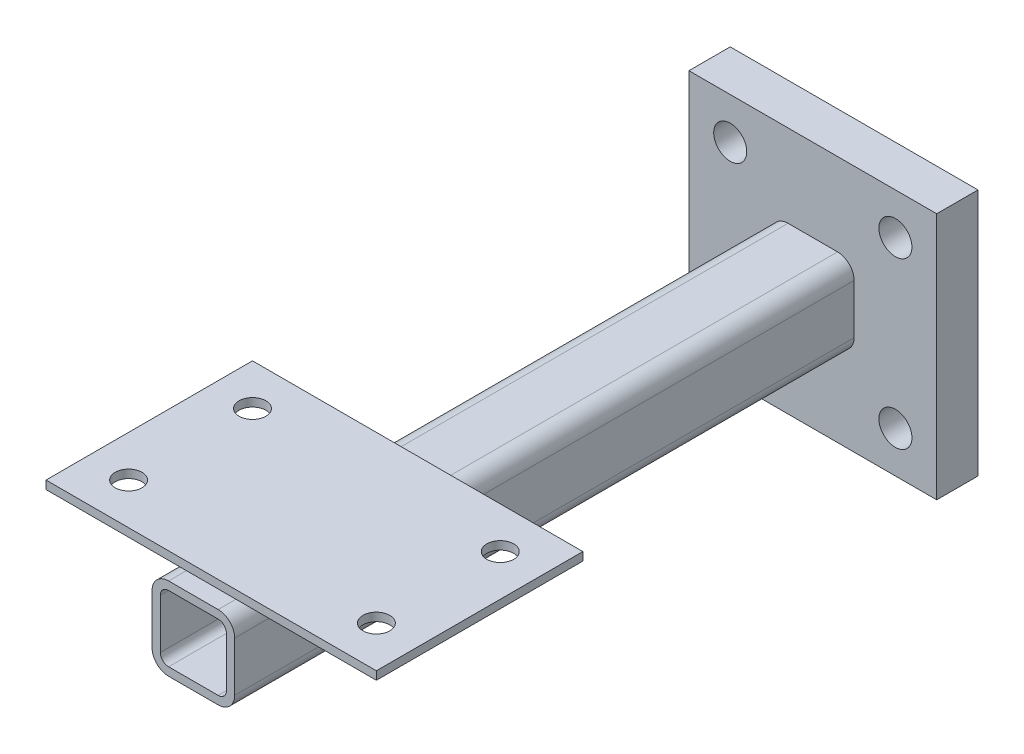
SolidWorks part; units mm, degrees
ref_plane "Front Plane" through (0, 0, 0) normal (0, 0, 1) x (1, 0, 0)
ref_plane "Top Plane" through (0, 0, 0) normal (0, 1, 0) x (1, 0, 0)
ref_plane "Right Plane" through (0, 0, 0) normal (1, 0, 0) x (0, 0, -1)
sketch "Sketch1" plane through (0, 0, 0) normal (0, 0, 1) x (1, 0, 0)
  line L1 (-30, 30) -> (30, 30)
  line L2 (-30, 30) -> (-30, -30)
  line L3 (-30, -30) -> (30, -30)
  line L4 (30, 30) -> (30, -30)
  line L5 (-30, 30) -> (30, -30) construction
  line L6 (-30, -30) -> (30, 30) construction
  point P0 (0, 0)
  dimension "D1" = 60
  dimension "D2" = 60
extrude "Boss-Extrude1" add sketch "Sketch1" along normal blind 10
sketch "Sketch2" plane through (0, 0, 0) normal (1, 0, 0) x (0, 0, -1)
  line L0 (-10, 0) -> (-160, 0)
  line L1 (-10, -30) -> (-10, 30) construction
  dimension "D1" = 150
other "Square tube 20 X 20 X 2(2)"
ref_plane "Plane4" through (0, 0, 10) normal (0, 0, 1) x (0, -1, 0)
sketch "Sketch14" plane through (0, 0, 10) normal (0, 0, 1) x (0, -1, 0)
  line L0 (-6, -8) -> (6, -8)
  line L1 (-8, -6) -> (-8, 6)
  line L2 (6, 8) -> (-6, 8)
  line L3 (8, 6) -> (8, -6)
  line L4 (-6, -10) -> (6, -10)
  line L5 (-10, -6) -> (-10, 6)
  line L6 (6, 10) -> (-6, 10)
  line L7 (10, 6) -> (10, -6)
  arc A0 (10, 6) -> (6, 10) centre (6, 6) ccw
  arc A1 (6, -10) -> (10, -6) centre (6, -6) ccw
  arc A2 (-10, -6) -> (-6, -10) centre (-6, -6) ccw
  arc A3 (-6, 10) -> (-10, 6) centre (-6, 6) ccw
  arc A4 (-6, 8) -> (-8, 6) centre (-6, 6) ccw
  arc A5 (8, 6) -> (6, 8) centre (6, 6) ccw
  arc A6 (6, -8) -> (8, -6) centre (6, -6) ccw
  arc A7 (-8, -6) -> (-6, -8) centre (-6, -6) ccw
  point P0 (-10, 0)
  point P1 (10, 0)
  point P2 (0, 10)
  point P3 (0, -10)
  point P4 (0, 0)
  point P5 (-10, -10)
  point P6 (10, -10)
  point P7 (10, 10)
  point P8 (-10, 10)
  point P33 (0, 0)
  dimension "D1" = 4
  dimension "Thickness" = 2
  dimension "V_leg" = 20
sketch "Sketch15" plane through (0, 10, 0) normal (0, 1, 0) x (1, 0, 0)
  line L0 (0, -10) -> (0, -160) construction
  line L1 (-40, -105.686) -> (40, -105.686)
  line L2 (-40, -105.686) -> (-40, -155.686)
  line L3 (-40, -155.686) -> (40, -155.686)
  line L4 (40, -105.686) -> (40, -155.686)
  line L5 (-40, -105.686) -> (40, -155.686) construction
  line L6 (-40, -155.686) -> (40, -105.686) construction
  point P0 (0, -130.686)
  dimension "D1" = 80
  dimension "D2" = 50
base flange "Base-Flange1" sketch "Sketch15" thickness 2 reverse thickness direction yes parameters "D1"=0.5
sketch "Sketch20" plane through (0, 0, 10) normal (0, 0, 1) x (1, 0, 0)
  line L0 (30, 30) -> (-30, 30) construction
  line L1 (-30, 30) -> (-30, -30) construction
  circle A0 centre (-20, 20) radius 4
  circle A1 centre (20, 20) radius 4
  circle A2 centre (20, -20) radius 4
  circle A3 centre (-20, -20) radius 4
  dimension "D1" = 8
  dimension "D2" = 10
  dimension "D3" = 10
  dimension "D4" = 2
  dimension "D5" = 2
extrude "Cut-Extrude1" cut sketch "Sketch20" against normal blind 10 contours A1 | A2 | A3 | A0
sketch "Sketch21" plane through (0, 12, 0) normal (0, 1, 0) x (1, 0, 0)
  line L0 (-40, -105.686) -> (-40, -155.686) construction
  line L1 (40, -105.686) -> (-40, -105.686) construction
  circle A0 centre (-30, -115.686) radius 3.25
  circle A1 centre (30, -115.686) radius 3.25
  circle A2 centre (30, -145.686) radius 3.25
  circle A3 centre (-30, -145.686) radius 3.25
  dimension "D1" = 6.5
  dimension "D2" = 10
  dimension "D3" = 10
  dimension "D4" = 2
  dimension "D5" = 2
extrude "Cut-Extrude2" cut sketch "Sketch21" against normal blind 10
sketch "Bend-Lines1" [suppressed] plane through (0, 0, 0) normal (0, 1, 0) x (1, 0, 0)
sketch "Bounding-Box1" [suppressed] plane through (0, 0, 0) normal (0, 1, 0) x (1, 0, 0)
sheet metal parameters "Sheet-Metal4" thickness 2 parameters "D1"=0.5
flat pattern "Flat-Pattern4"
sketch "Bend-Lines2" plane through (0, 0, 0) normal (0, 1, 0) x (1, 0, 0)
sketch3d "Bounding-Box2" [suppressed]
  line L0 (-40, -155.686, 0) -> (40, -155.686, 0) construction
  line L1 (-40, -105.686, 0) -> (40, -105.686, 0) construction
  line L2 (-40, -155.686, 0) -> (-40, -105.686, 0) construction
  line L3 (40, -155.686, 0) -> (40, -105.686, 0) construction
sheet metal parameters "Sheet-Metal6" thickness 2 parameters "D1"=0.5
flat pattern "Flat-Pattern4"
sketch "Bend-Lines2" plane through (0, 0, 0) normal (0, 1, 0) x (1, 0, 0)
sketch3d "Bounding-Box2" [suppressed]
  line L0 (-40, -155.686, 0) -> (40, -155.686, 0) construction
  line L1 (-40, -105.686, 0) -> (40, -105.686, 0) construction
  line L2 (-40, -155.686, 0) -> (-40, -105.686, 0) construction
  line L3 (40, -155.686, 0) -> (40, -105.686, 0) construction
